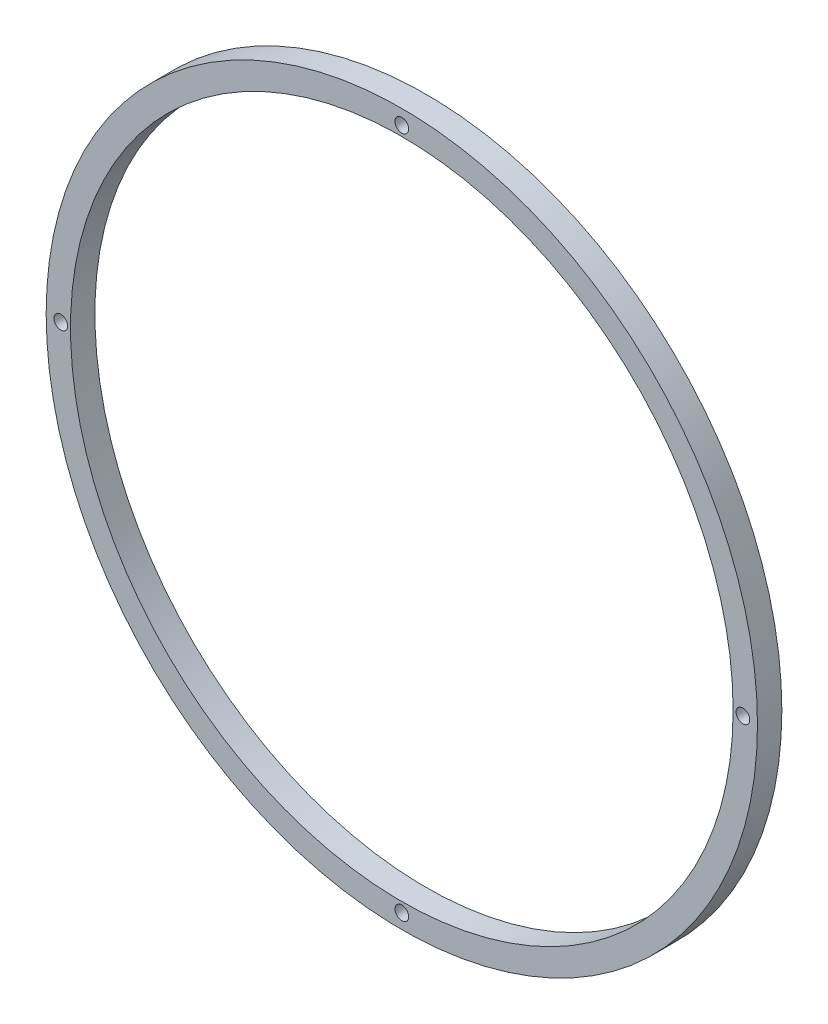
SolidWorks part; units mm, degrees
ref_plane "Front Plane" through (0, 0, 0) normal (0, 0, 1) x (1, 0, 0)
ref_plane "Top Plane" through (0, 0, 0) normal (0, 1, 0) x (1, 0, 0)
ref_plane "Right Plane" through (0, 0, 0) normal (1, 0, 0) x (0, 0, -1)
sketch "Sketch1" plane through (0, 0, 0) normal (0, 0, 1) x (1, 0, 0)
  line L0 (0, 88.9) -> (0, 0) construction
  line L1 (0, 0) -> (-88.9, 0) construction
  circle A0 centre (0, 0) radius 86.36
  circle A1 centre (0, 0) radius 92.71
  circle A2 centre (0, 88.9) radius 1.7859
  circle A3 centre (88.9, 0) radius 1.7859
  circle A4 centre (0, -88.9) radius 1.7859
  circle A5 centre (-88.9, 0) radius 1.7859
  point P15 (0, 0)
  dimension "D1" = 172.72
  dimension "D2" = 185.42
  dimension "D3" = 3.5719
  dimension "D4" = 88.9
  dimension "D6" = 88.9
  dimension "D5" = 4
extrude "Boss-Extrude1" add sketch "Sketch1" along normal blind 6.35 contours A1 A5 A4 A3 A2 A0
